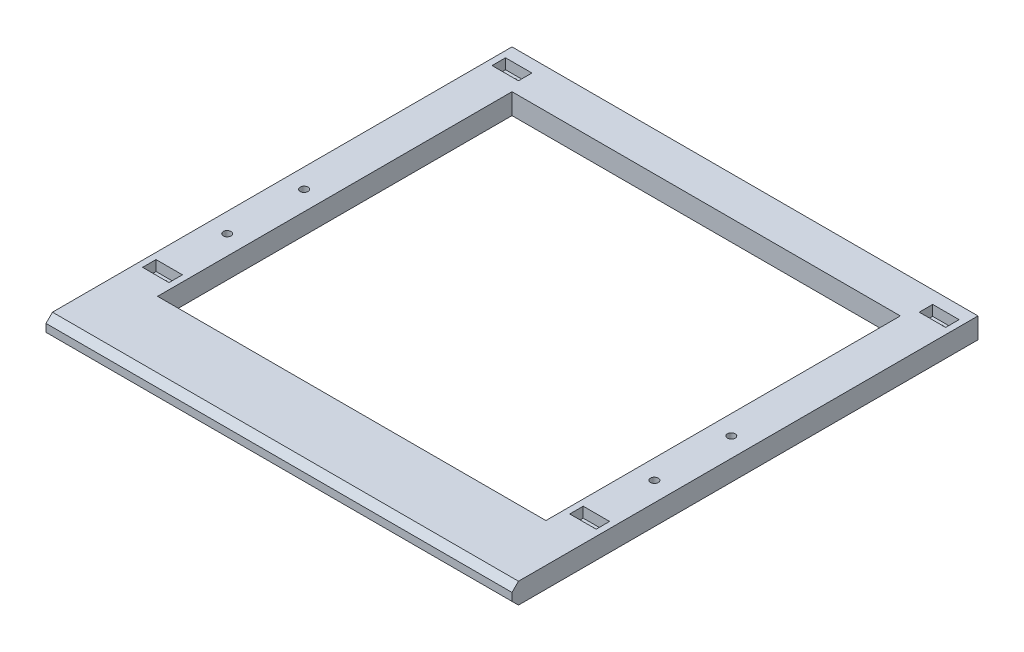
SolidWorks part; units mm, degrees
other "<Y轴滑轨>-<镜向1>"
other "<Y轴滑轨>-<<齿条1.5---SAll>-<TeethCuts>>"
ref_plane "前视基准面" through (0, 0, 0) normal (0, 0, 1) x (1, 0, 0)
ref_plane "上视基准面" through (0, 0, 0) normal (0, 1, 0) x (1, 0, 0)
ref_plane "右视基准面" through (0, 0, 0) normal (1, 0, 0) x (0, 0, -1)
mirrored part "Y轴滑轨镜向"
